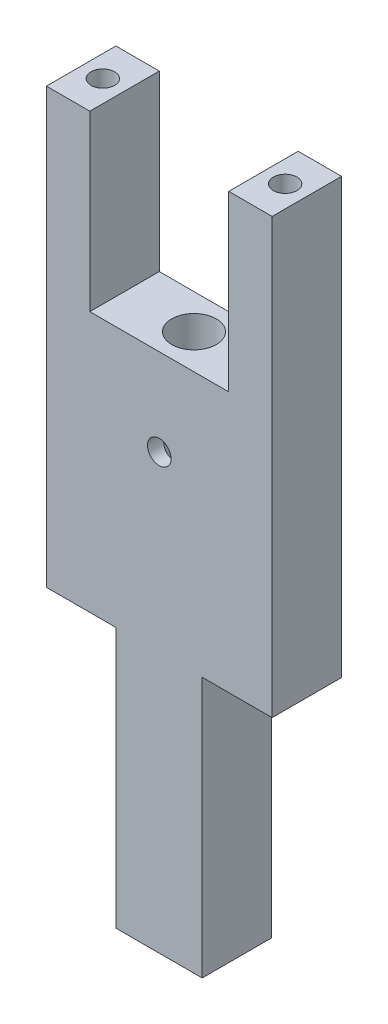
SolidWorks part; units mm, degrees
ref_plane "Front Plane" through (0, 0, 0) normal (0, 0, 1) x (1, 0, 0)
ref_plane "Top Plane" through (0, 0, 0) normal (0, 1, 0) x (1, 0, 0)
ref_plane "Right Plane" through (0, 0, 0) normal (1, 0, 0) x (0, 0, -1)
sketch "Sketch1" plane through (0, 0, 0) normal (0, 0, 1) x (1, 0, 0)
  line L1 (-17.878, 21.8144) -> (15.142, 21.8144)
  line L2 (-17.878, 21.8144) -> (-17.878, -79.7856)
  line L3 (-17.878, -79.7856) -> (15.142, -79.7856)
  line L4 (15.142, 21.8144) -> (15.142, -79.7856)
  dimension "D1" = 33.02
extrude "Boss-Extrude2" add sketch "Sketch1" along normal blind 10.16
sketch "Sketch3" plane through (0, 0, 10.16) normal (0, 0, 1) x (1, 0, 0)
  line L0 (-17.878, -79.7856) -> (15.142, -79.7856) construction
  line L1 (-7.718, -79.7856) -> (4.9101, -79.7856)
  line L2 (-7.718, -79.7856) -> (-7.718, -41.6856)
  line L3 (-7.718, -41.6856) -> (4.9101, -41.6856)
  line L4 (4.9101, -79.7856) -> (4.9101, -41.6856)
  line L5 (-17.878, 21.8144) -> (-17.878, -79.7856) construction
  line L6 (-7.718, -41.6856) -> (-17.878, -41.6856)
  line L7 (-17.878, -41.6856) -> (15.142, -41.6856)
  line L8 (15.142, -79.7856) -> (15.142, 21.8144) construction
  line L9 (15.142, -41.6856) -> (-7.718, -41.6856)
  dimension "D1" = 10.16
extrude "Cut-Extrude1" cut sketch "Sketch3" against normal blind 10.16 contours L2 L6 M2 M3 | L7 L4 M3 M4
sketch "Sketch4" plane through (0, 0, 10.16) normal (0, 0, 1) x (1, 0, 0)
  line L0 (15.142, 21.8144) -> (-17.878, 21.8144) construction
  line L1 (-11.528, 21.8144) -> (8.792, 21.8144)
  line L2 (-11.528, 21.8144) -> (-11.528, -3.5856)
  line L3 (-11.528, -3.5856) -> (8.792, -3.5856)
  line L4 (8.792, 21.8144) -> (8.792, -3.5856)
  line L5 (-17.878, 21.8144) -> (-17.878, -41.6856) construction
  line L6 (15.142, -41.6856) -> (15.142, 21.8144) construction
  dimension "D1" = 6.35
  dimension "D2" = 6.35
extrude "Cut-Extrude2" cut sketch "Sketch4" against normal blind 10.16
hole_wizard "F (0.257) Diameter Hole1" positions "Sketch5" profile "Sketch6" hole size "F" standard "ANSI Inch"
sketch "Sketch5" plane through (0, -3.5856, 0) normal (0, 1, 0) x (1, 0, 0)
  line L0 (-11.528, 0) -> (8.792, 0) construction
  line L1 (-17.878, -10.16) -> (-17.878, 0) construction
  point P0 (-1.368, -5.08)
  dimension "D1" = 5.08
  dimension "D2" = 16.51
sketch "Sketch6" plane through (-1.368, -3.5856, 5.08) normal (1, 0, 0) x (0, 0, 1)
  line L0 (0, 0) -> (0, 65.4611)
  line L1 (0, 65.4611) -> (3.2639, 63.5)
  line L2 (3.2639, 63.5) -> (3.2639, 0)
  line L5 (3.2639, 0) -> (0, 0)
  line L10 (0, 65.4611) -> (-3.2639, 63.5) construction
  line L11 (0, -6.35) -> (0, 107.95) construction
  dimension "Hole Dia." = 6.5278
  dimension "Hole Depth" = 63.5
  dimension "Drill Angle" = 118
hole_wizard "#8-32 Tapped Hole1" positions "Sketch7" profile "Sketch8" tap size "#8-32" standard "ANSI Inch"
sketch "Sketch7" plane through (0, 21.8144, 0) normal (0, 1, 0) x (1, 0, 0)
  line L0 (-11.528, 0) -> (-17.878, 0) construction
  line L1 (15.142, 0) -> (8.792, 0) construction
  line L2 (15.142, -10.16) -> (15.142, 0) construction
  line L3 (-17.878, -10.16) -> (-17.878, 0) construction
  point P0 (-14.703, -5.08)
  point P2 (11.967, -5.08)
  dimension "D1" = 5.08
  dimension "D2" = 5.08
  dimension "D3" = 3.175
  dimension "D4" = 3.175
sketch "Sketch8" plane through (-14.703, 21.8144, 5.08) normal (1, 0, 0) x (0, 0, 1)
  line L0 (0, 0) -> (0, 13.7378)
  line L1 (0, 13.7378) -> (1.7272, 12.7)
  line L2 (1.7272, 12.7) -> (1.7272, 0)
  line L5 (1.7272, 0) -> (0, 0)
  line L10 (0, 13.7378) -> (-1.7272, 12.7) construction
  line L11 (0, -6.35) -> (0, 107.95) construction
  dimension "Tap Drill Dia." = 3.4544
  dimension "Tap Drill Depth" = 12.7
  dimension "Drill Angle" = 118
hole_wizard "1/4-20 Tapped Hole1" positions "Sketch11" profile "Sketch10" tap size "1/4-20" standard "ANSI Inch"
sketch "Sketch11" plane through (0, -79.7856, 0) normal (0, -1, 0) x (-1, 0, 0)
  line L0 (7.718, 0) -> (-4.9101, 0) construction
  line L2 (7.718, 0) -> (7.718, -10.16) construction
  point P0 (1.368, -5.08)
  dimension "D1" = 5.08
  dimension "D2" = 6.35
sketch "Sketch10" plane through (-1.368, -79.7856, 5.08) normal (1, 0, 0) x (0, 0, -1)
  line L0 (0, 0) -> (0, 14.2338)
  line L1 (0, 14.2338) -> (2.5527, 12.7)
  line L2 (2.5527, 12.7) -> (2.5527, 0)
  line L5 (2.5527, 0) -> (0, 0)
  line L10 (0, 14.2338) -> (-2.5527, 12.7) construction
  line L11 (0, -6.35) -> (0, 107.95) construction
  dimension "Tap Drill Dia." = 5.1054
  dimension "Tap Drill Depth" = 12.7
  dimension "Drill Angle" = 118
hole_wizard "#8-32 Tapped Hole2" positions "Sketch12" profile "Sketch13" tap size "#8-32" standard "ANSI Inch"
sketch "Sketch12" plane through (0, 0, 10.16) normal (0, 0, 1) x (1, 0, 0)
  line L0 (15.142, -41.6856) -> (15.142, 21.8144) construction
  line L1 (-11.528, -3.5856) -> (8.792, -3.5856) construction
  point P0 (-1.368, -16.2856)
  dimension "D1" = 16.51
  dimension "D2" = 12.7
sketch "Sketch13" plane through (-1.368, -16.2856, 10.16) normal (1, 0, 0) x (0, -1, 0)
  line L0 (0, 0) -> (0, 1.8161)
  line L1 (0, 1.8161) -> (1.7272, 1.8161)
  line L2 (1.7272, 1.8161) -> (1.7272, 0)
  line L5 (1.7272, 0) -> (0, 0)
  line L11 (0, -6.35) -> (0, 107.95) construction
  dimension "Thru Tap Drill Dia." = 3.4544
  dimension "Thru Tap Drill Depth" = 1.8161
